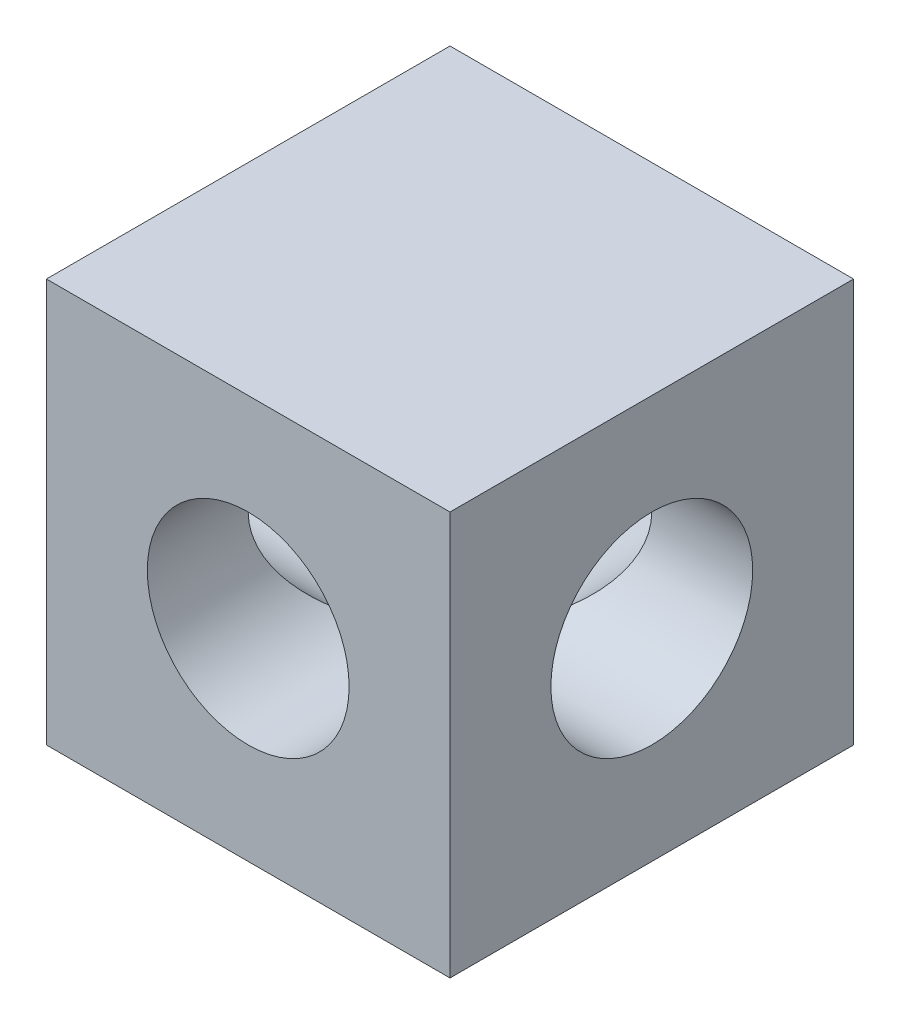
SolidWorks part; units mm, degrees
ref_plane "Front" through (0, 0, 0) normal (0, 0, 1) x (1, 0, 0)
ref_plane "Top" through (0, 0, 0) normal (0, 1, 0) x (-1, 0, 0)
ref_plane "Right" through (0, 0, 0) normal (1, 0, 0) x (0, 0, -1)
sketch "Sketch1" plane through (0, 0, 0) normal (0, 0, 1) x (1, 0, 0)
  line L0 (-9.525, -9.525) -> (9.525, -9.525)
  line L1 (-9.525, -9.525) -> (-9.525, 9.525)
  line L2 (9.525, 9.525) -> (-9.525, 9.525)
  line L3 (9.525, 9.525) -> (9.525, -9.525)
  line L4 (9.525, 9.525) -> (-9.525, -9.525) construction
  circle A0 centre (0, 0) radius 4.7625
  dimension "R" = 9.525
  dimension "cube" = 19.05
extrude "Base-Extrude" add sketch "Sketch1" along normal mid plane 19.05
sketch "Sketch3" plane through (9.525, 0, 0) normal (1, 0, 0) x (0, 0, -1)
  circle A0 centre (0, 0) radius 4.7625
extrude "Cut-Extrude1" cut sketch "Sketch3" against normal through all
